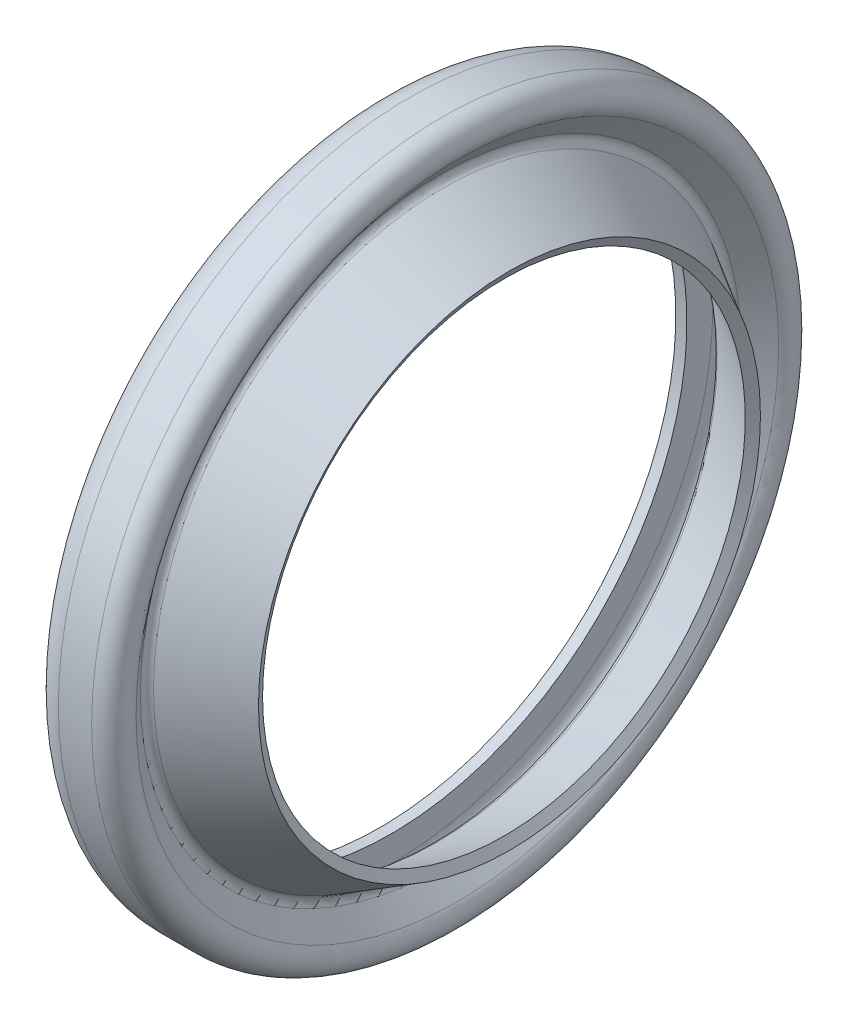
SolidWorks part; units mm, degrees
ref_plane "Plan de face" through (0, 0, 0) normal (0, 0, 1) x (1, 0, 0)
ref_plane "Plan de dessus" through (0, 0, 0) normal (0, 1, 0) x (1, 0, 0)
ref_plane "Plan de droite" through (0, 0, 0) normal (1, 0, 0) x (0, 0, -1)
sketch "Esquisse1" plane through (0, 0, 0) normal (0, 0, 1) x (1, 0, 0)
  line L0 (0, 80) -> (0, 87)
  line L1 (8, 95) -> (17, 95)
  line L2 (20.9164, 86.8916) -> (16.4334, 81.2433)
  line L3 (17, 78.2679) -> (35, 67.8756)
  line L4 (3, 80) -> (3, 87)
  line L5 (8, 92) -> (17, 92)
  line L6 (18.5666, 88.7567) -> (14.0836, 83.1084)
  line L7 (15.5, 75.6699) -> (33.5, 65.2776)
  line L8 (0, 80) -> (3, 80)
  line L9 (33.5, 65.2776) -> (35, 67.8756)
  line L10 (0, 0) -> (25.9577, 0) construction
  arc A0 (8, 95) -> (0, 87) centre (8, 87) ccw
  arc A1 (20.9164, 86.8916) -> (17, 95) centre (17, 90) ccw
  arc A2 (16.4334, 81.2433) -> (17, 78.2679) centre (18, 80) ccw
  arc A3 (8, 92) -> (3, 87) centre (8, 87) ccw
  arc A4 (18.5666, 88.7567) -> (17, 92) centre (17, 90) ccw
  arc A5 (14.0836, 83.1084) -> (15.5, 75.6699) centre (18, 80) ccw
  arc A6 (20.9164, 86.8916) -> (17, 95) centre (17, 90) ccw construction
  arc A7 (16.4334, 81.2433) -> (17, 78.2679) centre (18, 80) ccw construction
  dimension "D4" = 5
  dimension "D5" = 17
  dimension "D6" = 5
  dimension "D7" = 8
  dimension "D8" = 80
  dimension "D11" = 1
  dimension "D2" = 95
  dimension "D3" = 80
  dimension "D9" = 35
  dimension "D10" = 30
  dimension "D1" = 3
revolve "Révolution1" add sketch "Esquisse1" angle 360 about L10
